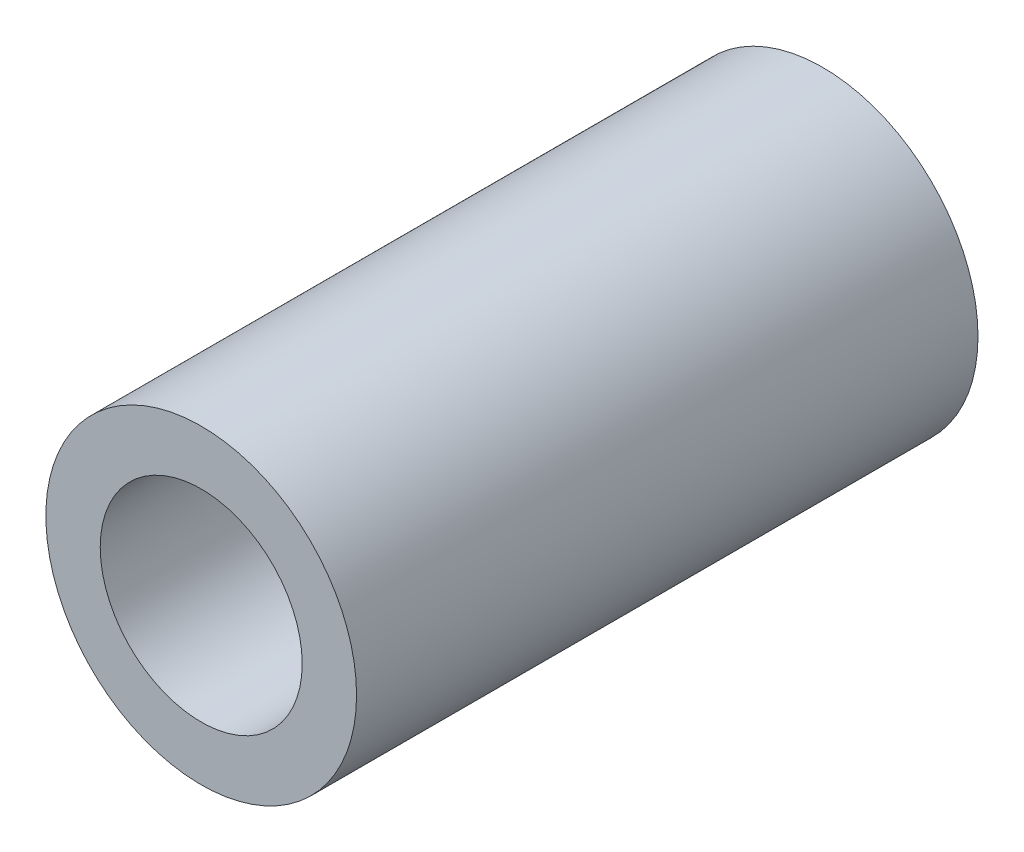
SolidWorks part; units mm, degrees
ref_plane "Front Plane" through (0, 0, 0) normal (0, 0, 1) x (1, 0, 0)
ref_plane "Top Plane" through (0, 0, 0) normal (0, 1, 0) x (1, 0, 0)
ref_plane "Right Plane" through (0, 0, 0) normal (1, 0, 0) x (0, 0, -1)
sketch "Sketch1" plane through (0, 0, 0) normal (0, 0, 1) x (1, 0, 0)
  circle A0 centre (0, 0) radius 5
  circle A1 centre (0, 0) radius 3.25
  dimension "D1" = 6.5
  dimension "D2" = 10
extrude "Extrude1" add sketch "Sketch1" along normal blind 20
